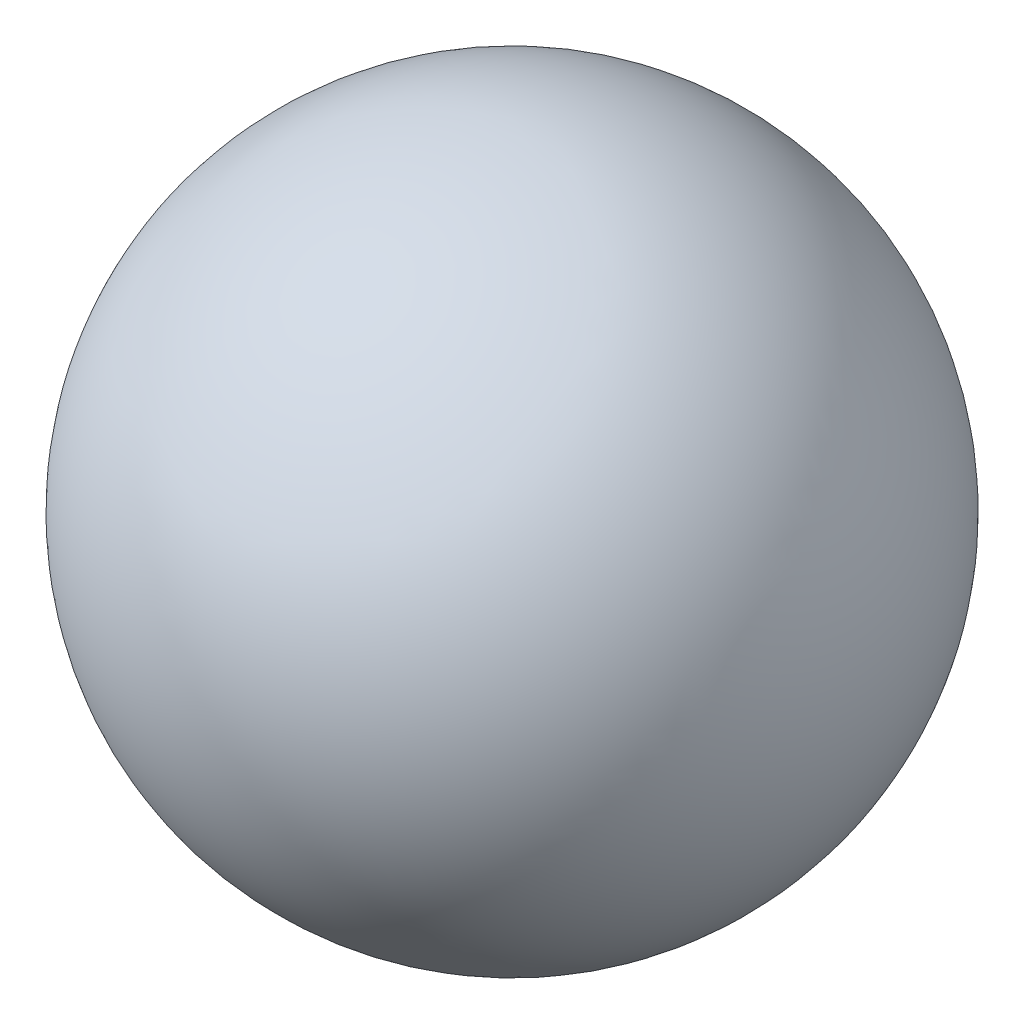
SolidWorks part; units mm, degrees
ref_plane "Front Plane" through (0, 0, 0) normal (0, 0, 1) x (1, 0, 0)
ref_plane "Top Plane" through (0, 0, 0) normal (0, 1, 0) x (1, 0, 0)
ref_plane "Right Plane" through (0, 0, 0) normal (1, 0, 0) x (0, 0, -1)
ref_plane "Plane4" through (0, 0, 0) normal (0, 0, 1) x (1, 0, 0)
sketch "Sketch1" plane through (0, 0, 0) normal (0, 0, 1) x (1, 0, 0)
  line L0 (3.69, 6.5) -> (1.31, 6.5)
  line L1 (50, 6.5) -> (-50, 6.5) construction
  arc A0 (1.31, 6.5) -> (3.69, 6.5) centre (2.5, 6.5) cw
  dimension "D1" = 1.19
  dimension "D2" = 6.5
  dimension "D3" = 2.5
revolve "Revolve1" add sketch "Sketch1" angle 360 about L1
